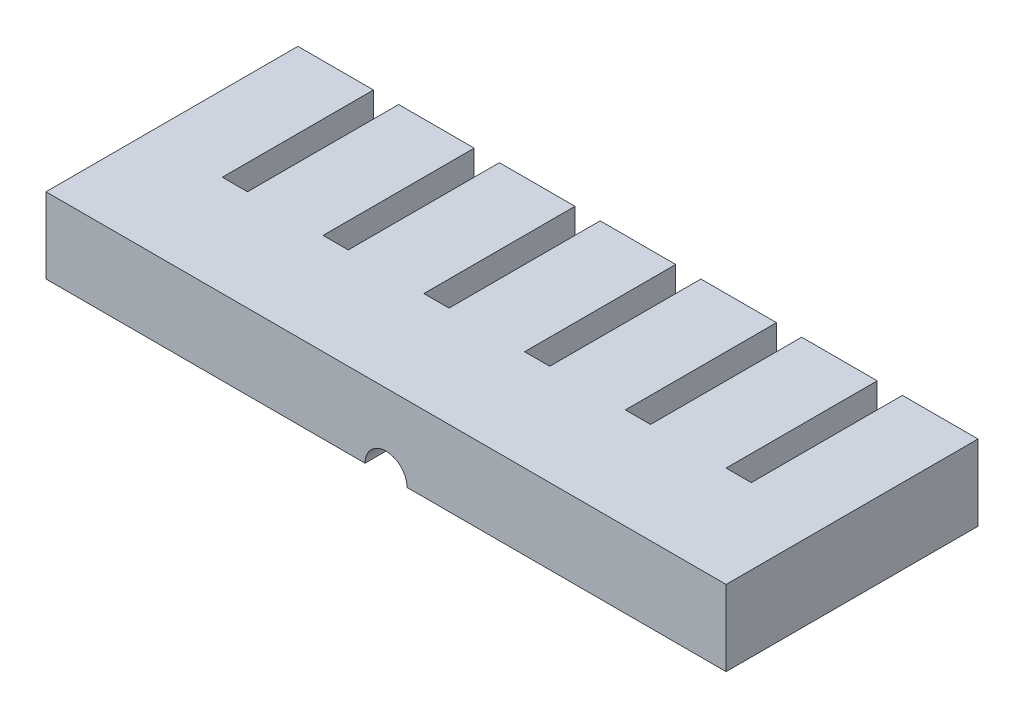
SolidWorks part; units mm, degrees
ref_plane "Front" through (0, 0, 0) normal (0, 0, 1) x (1, 0, 0)
ref_plane "Top" through (0, 0, 0) normal (0, 1, 0) x (1, 0, 0)
ref_plane "Right" through (0, 0, 0) normal (1, 0, 0) x (0, 0, -1)
body saved out of another part "Stock-finger-1"
